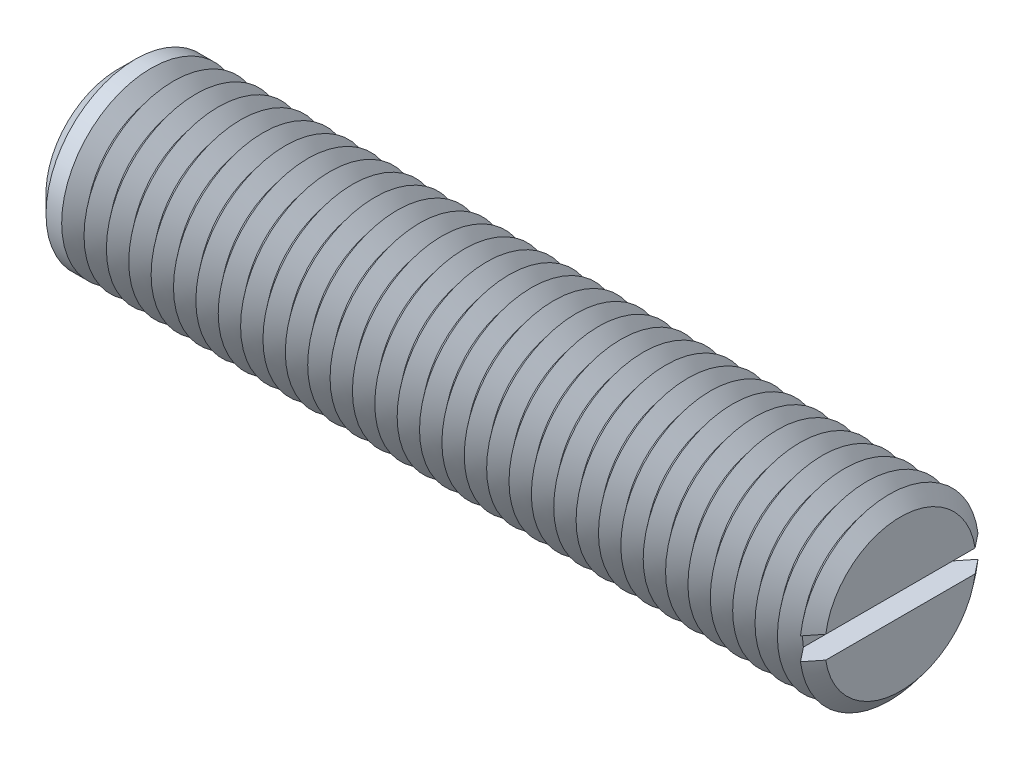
SolidWorks part; units mm, degrees
ref_plane "Front Plane" through (0, 0, 0) normal (0, 0, 1) x (1, 0, 0)
ref_plane "Top Plane" through (0, 0, 0) normal (0, 1, 0) x (1, 0, 0)
ref_plane "Right Plane" through (0, 0, 0) normal (1, 0, 0) x (0, 0, -1)
sketch "Sketch1" plane through (0, 0, 0) normal (1, 0, 0) x (0, 0, -1)
  circle A0 centre (0, 0) radius 8
  dimension "D1" = 16
extrude "Extrude1" add sketch "Sketch1" along normal mid plane 70
sketch "Sketch2" plane through (0, 0, 0) normal (0, 0, 1) x (1, 0, 0)
  line L0 (35, 1) -> (33, 1)
  line L1 (35, -8) -> (35, 8) construction
  line L2 (33, 1) -> (33, -1)
  line L3 (0, 0) -> (50000, 0) construction
  line L4 (35, -1) -> (33, -1)
  line L5 (35, -1) -> (35, 1)
  point P9 (33, 0)
  dimension "D1" = 2
extrude "Extrude2" cut sketch "Sketch2" against normal mid plane 24
chamfer "Chamfer1" distance 1.6 angle 45 1 edges at (-35, 0, -8)
sketch "Sketch3" plane through (0, 0, 0) normal (0, 0, 1) x (1, 0, 0)
  line L0 (0, 0) -> (30.9602, 0) construction
  line L1 (34, -8) -> (36, -8)
  line L2 (-33.4, -8) -> (35, -8) construction
  line L3 (36, -8) -> (35, -6.751)
  line L4 (35, -8) -> (35, -1) construction
  line L5 (35, -6.751) -> (34, -8)
  dimension "D1" = 2
  dimension "D2" = 1.6
revolve "Cut-Revolve1" cut sketch "Sketch3" angle 360 about L0
pattern_linear "LPattern1" count 34 spacing 2 along (-1, 0, 0) of "Cut-Revolve1"
equation "\"D2@Sketch3\" = \"D1@Sketch3\"*0.8"
